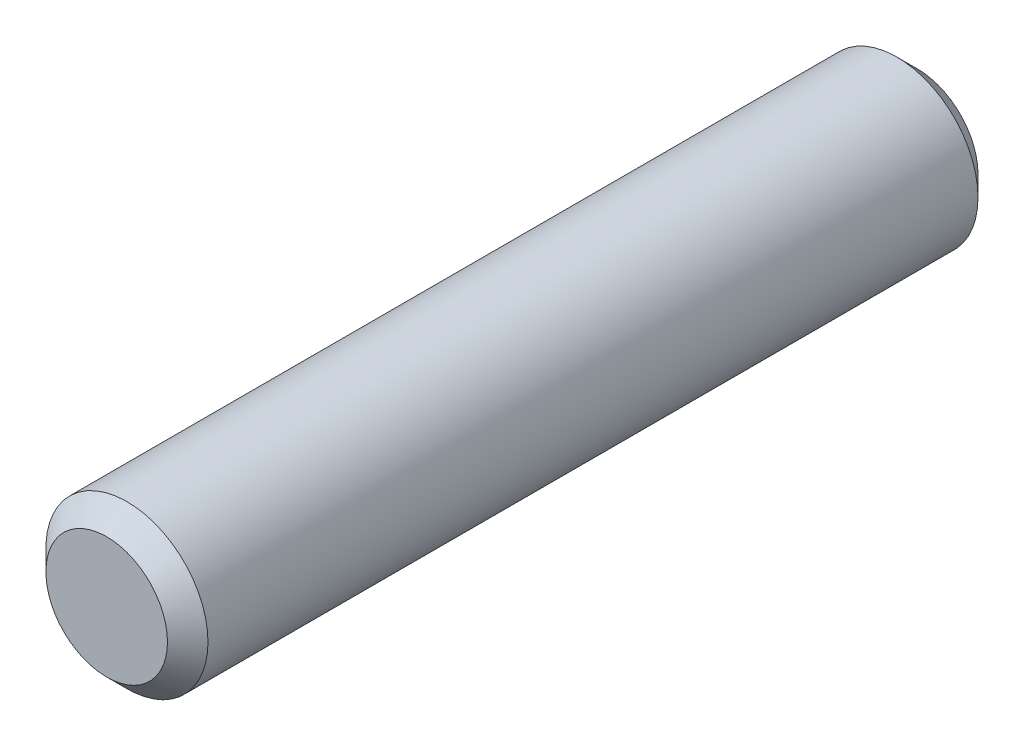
SolidWorks part; units mm, degrees
ref_plane "Plan1" through (0, 0, 0) normal (0, 0, 1) x (1, 0, 0)
ref_plane "Plan2" through (0, 0, 0) normal (0, 1, 0) x (1, 0, 0)
ref_plane "Plan3" through (0, 0, 0) normal (1, 0, 0) x (0, 0, -1)
sketch "Esquisse1" plane through (0, 0, 0) normal (0, 0, 1) x (1, 0, 0)
  circle A0 centre (0, 0) radius 4
  dimension "D1" = 8
extrude "Base-Extrusion" add sketch "Esquisse1" along normal blind 40
chamfer "Chanfrein2" distance 1 angle 45 2 edges at (4, 0, 0) (4, 0, 40)
